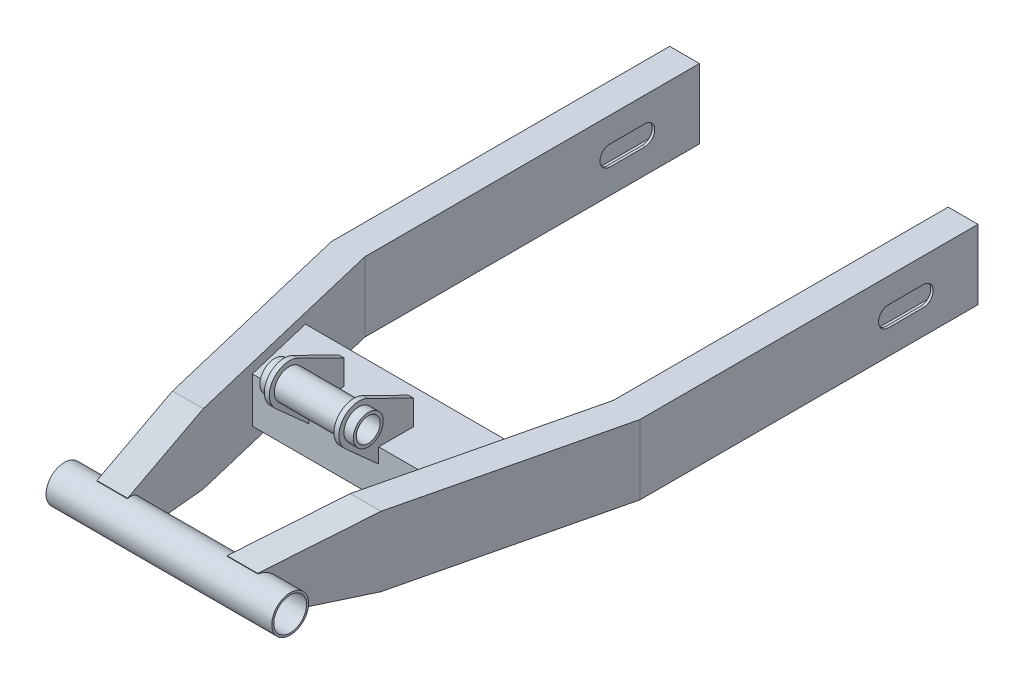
SolidWorks part; units mm, degrees
ref_plane "Plan de face" through (0, 0, 0) normal (0, 0, 1) x (1, 0, 0)
ref_plane "Plan de dessus" through (0, 0, 0) normal (0, 1, 0) x (1, 0, 0)
ref_plane "Plan de droite" through (0, 0, 0) normal (1, 0, 0) x (0, 0, -1)
sketch "Esquisse1" plane through (0, 0, 0) normal (0, 1, 0) x (1, 0, 0)
  line L0 (0, 0) -> (0, 246.6202) construction
  line L1 (-125, 313.5382) -> (-50, 0)
  line L2 (-155, 650) -> (-125, 650)
  line L3 (-155, 650) -> (-155, 310)
  line L4 (-80.8463, 0) -> (-50, 0)
  line L5 (-125, 650) -> (-125, 313.5382)
  line L6 (125, 650) -> (125, 313.5382)
  line L7 (155, 650) -> (125, 650)
  line L8 (155, 650) -> (155, 310)
  line L9 (-155, 310) -> (-80.8463, 0)
  line L10 (80.8463, 0) -> (50, 0)
  line L12 (0, 0) -> (-307.2047, 0) construction
  line L16 (155, 310) -> (80.8463, 0)
  line L17 (125, 313.5382) -> (50, 0)
  dimension "D1" = 250
  dimension "D2" = 30
  dimension "D3" = 100
  dimension "D4" = 340
  dimension "D6" = 30
  dimension "D8" = 650
extrude "Extrusion1" add sketch "Esquisse1" along normal mid plane 70
sketch "Esquisse2" plane through (0, 0, 0) normal (0, 1, 0) x (1, 0, 0)
  line L0 (-241.6107, 0) -> (280.7606, 0) construction
  line L2 (-113.5, 0) -> (113.5, 0)
  line L3 (-113.5, 0) -> (-113.5, 18.5)
  line L4 (-113.5, 18.5) -> (113.5, 18.5)
  line L5 (113.5, 0) -> (113.5, 18.5)
  dimension "D1" = 37
  dimension "D2" = 227
revolve "Révolution1" add sketch "Esquisse2" angle 360 about L0
chamfer "Chanfrein1" distance 16 distance2 100 2 edges at (65.4232, 35, 0) (-65.4232, 35, 0)
chamfer "Chanfrein2" distance 100 distance2 16 2 edges at (65.4232, -35, 0) (-65.4232, -35, 0)
sketch "Esquisse3" plane through (0, 0, 0) normal (0, 1, 0) x (1, 0, 0)
  line L0 (-216.6864, 0) -> (248.2811, 0) construction
  line L1 (-113.5, 18.5) -> (-113.5, -18.5) construction
  line L2 (-113.5, 0) -> (113.5, 0)
  line L3 (-113.5, 0) -> (-113.5, 16.5)
  line L4 (-113.5, 16.5) -> (113.5, 16.5)
  line L5 (113.5, 0) -> (113.5, 16.5)
  line L6 (113.5, -18.5) -> (113.5, 18.5) construction
  dimension "D1" = 33
revolve "Enlèvement de matière-Révolution1" cut sketch "Esquisse3" angle 360 about L0
shell "Coque1" thickness 2.5
sketch "Esquisse6" plane through (0, 0, 0) normal (1, 0, 0) x (0, 0, -1)
  circle A0 centre (145, 54.7723) radius 15
  circle A1 centre (145, 54.7723) radius 12
  circle A2 centre (0, 0) radius 18.5 construction
  dimension "D1" = 30
  dimension "D4" = 145
  dimension "D3" = 155
  dimension "D2" = 3
extrude "Extrusion4" add sketch "Esquisse6" along normal mid plane 94
ref_plane "Plan1" through (35, 0, 0) normal (1, 0, 0) x (0, 0, -1)
sketch "Esquisse9" plane through (0, 0, 0) normal (1, 0, 0) x (0, 0, -1)
  line L0 (168, 22) -> (168, -19.2574)
  line L1 (165, 25) -> (235, 25)
  line L2 (165, 25) -> (165, -20.5)
  line L3 (180, -35.5) -> (235, -35.5)
  line L4 (235, 25) -> (235, -35.5)
  line L5 (181.2426, -32.5) -> (232, -32.5)
  line L6 (232, 22) -> (232, -32.5)
  line L7 (168, 22) -> (232, 22)
  line L9 (165, 25) -> (165, -35.5) construction
  line L10 (100, 35) -> (310, 35) construction
  line L11 (165, -35.5) -> (235, -35.5) construction
  line L12 (165, -20.5) -> (180, -35.5)
  line L13 (168, 22) -> (168, -32.5) construction
  line L14 (168, -32.5) -> (232, -32.5) construction
  line L15 (168, -19.2574) -> (181.2426, -32.5)
  line L16 (100.1987, -32.5) -> (310.2948, -32.5) construction
  arc A0 (0, -18.5) -> (0, 18.5) centre (0, 0) ccw construction
  dimension "D4" = 165
  dimension "D2" = 10
  dimension "D3" = 70
  dimension "D5" = 45
  dimension "D6" = 3
  dimension "D7" = 15
  dimension "D1" = 3
extrude "Extrusion6" add sketch "Esquisse9" against normal up to surface and the other way up to surface
sketch "Esquisse7" plane through (35, 0, 0) normal (1, 0, 0) x (0, 0, -1)
  line L0 (165, 25) -> (165, 10)
  line L1 (165, 25) -> (200, 25)
  line L2 (200, 25) -> (200, 50)
  line L3 (200, 50) -> (153.8298, 72.7176)
  line L4 (310, 35) -> (650, 35) construction
  line L5 (165, 25) -> (165, -20.5) construction
  line L6 (235, 25) -> (165, 25) construction
  line L7 (165, 25) -> (165, -20.5) construction
  line L8 (165, 10) -> (131.654, 39.8764)
  circle A2 centre (145, 54.7723) radius 12 construction
  circle A3 centre (145, 54.7723) radius 20
  arc A4 (153.8298, 72.7176) -> (131.654, 39.8764) centre (145, 54.7723) ccw
  circle A5 centre (145, 54.7723) radius 12
  dimension "D2" = 15
  dimension "D3" = 35
  dimension "D4" = 15
  dimension "D1" = 5
extrude "Extrusion5" add sketch "Esquisse7" along normal mid plane 5
pattern_linear "Répétition linéaire1" count 2 spacing 70 along (-1, 0, 0) of "Extrusion5"
sketch "Esquisse8" plane through (0, 0, 0) normal (1, 0, 0) x (0, 0, -1)
  line L0 (650, 0) -> (338.727, 0) construction
  line L1 (650, 35) -> (650, -35) construction
  line L2 (595, 10) -> (560, 10)
  line L3 (560, -10) -> (595, -10)
  arc A0 (560, 10) -> (560, -10) centre (560, 0) ccw
  arc A1 (595, -10) -> (595, 10) centre (595, 0) ccw
  dimension "D2" = 35
  dimension "D1" = 20
  dimension "D3" = 55
extrude "Enlèv. mat.-Extru.1" cut sketch "Esquisse8" against normal through all and the other way through all
